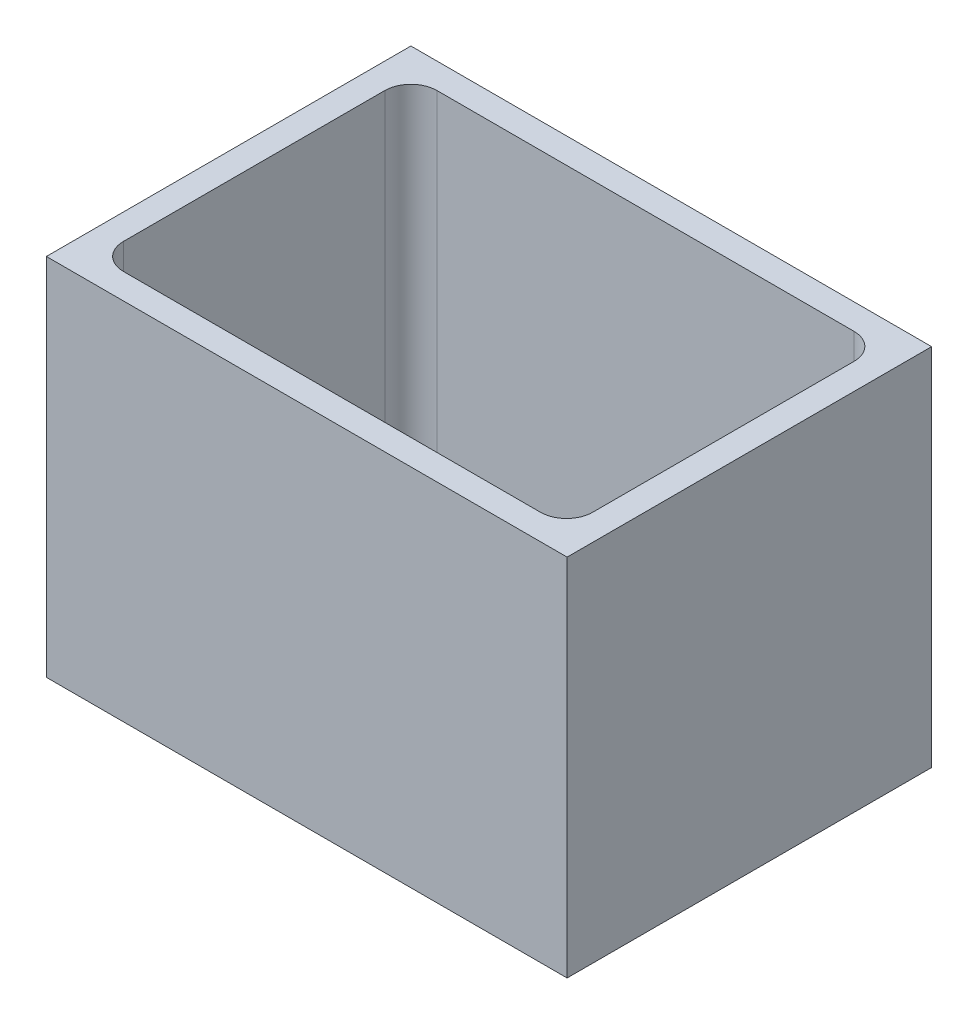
SolidWorks part; units mm, degrees
ref_plane "Front Plane" through (0, 0, 0) normal (0, 0, 1) x (1, 0, 0)
ref_plane "Top Plane" through (0, 0, 0) normal (0, 1, 0) x (1, 0, 0)
ref_plane "Right Plane" through (0, 0, 0) normal (1, 0, 0) x (0, 0, -1)
sketch "Sketch1" plane through (0, 0, 0) normal (0, 1, 0) x (1, 0, 0)
  line L1 (-76.2962, 34.5933) -> (50.7038, 34.5933)
  line L2 (-76.2962, 34.5933) -> (-76.2962, -54.3067)
  line L3 (-76.2962, -54.3067) -> (50.7038, -54.3067)
  line L4 (50.7038, 34.5933) -> (50.7038, -54.3067)
  dimension "D1" = 127
  dimension "D2" = 88.9
extrude "Boss-Extrude1" add sketch "Sketch1" along normal blind 88.9
sketch "Sketch2" plane through (0, 88.9, 0) normal (0, 1, 0) x (1, 0, 0)
  line L1 (-70.0732, 28.3703) -> (44.3538, 28.3703)
  line L2 (-70.0732, 28.3703) -> (-70.0732, -48.0837)
  line L3 (-70.0732, -48.0837) -> (44.3538, -48.0837)
  line L4 (44.3538, 28.3703) -> (44.3538, -48.0837)
  line L5 (-76.2962, 34.5933) -> (-76.2962, -54.3067) construction
  line L6 (50.7038, 34.5933) -> (-76.2962, 34.5933) construction
  circle A0 centre (-63.7232, 22.0203) radius 6.35
  circle A1 centre (38.0038, 22.0203) radius 6.35
  circle A2 centre (38.0038, -41.7337) radius 6.35
  circle A3 centre (-63.7232, -41.7337) radius 6.35
  dimension "D5" = 6.35
  dimension "D1" = 76.454
  dimension "D2" = 114.427
  dimension "D3" = 6.223
  dimension "D4" = 6.223
  dimension "D6" = 6.35
  dimension "D7" = 6.35
  dimension "D8" = 6.35
  dimension "D9" = 6.35
  dimension "D10" = 6.35
  dimension "D11" = 6.35
  dimension "D12" = 6.35
extrude "Cut-Extrude1" cut sketch "Sketch2" against normal through all contours A0 | A3 L3 A2 L4 A1 L1 A0 L2 | A1 | A2 | A3
